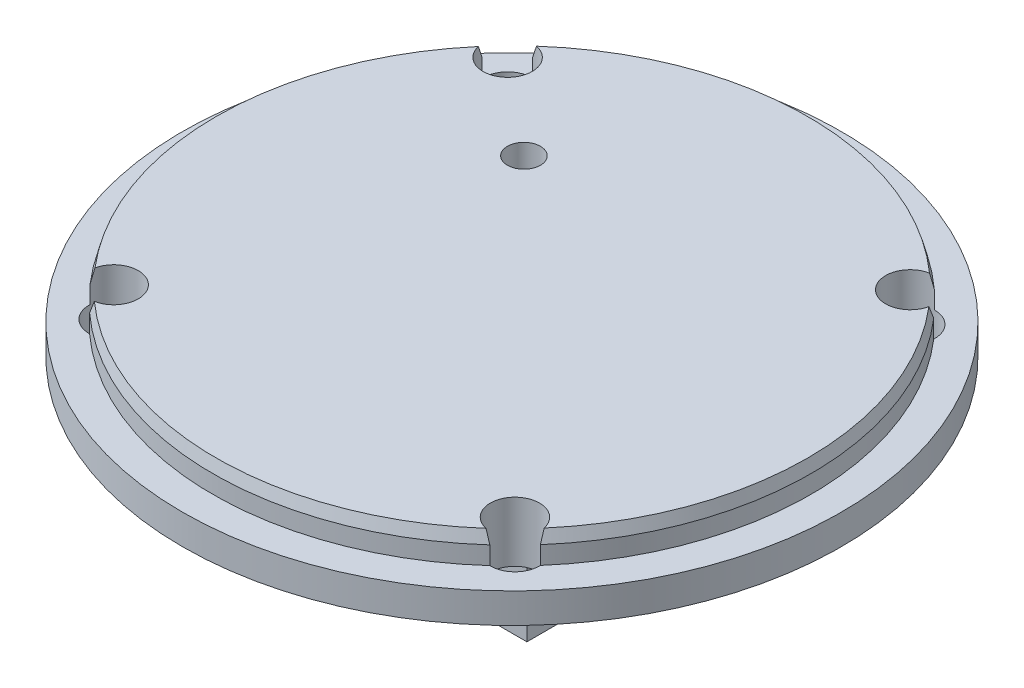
SolidWorks part; units mm, degrees
ref_plane "Спереди" through (0, 0, 0) normal (0, 0, 1) x (1, 0, 0)
ref_plane "Сверху" through (0, 0, 0) normal (0, 1, 0) x (1, 0, 0)
ref_plane "Справа" through (0, 0, 0) normal (1, 0, 0) x (0, 0, -1)
sketch "Эскиз1" plane through (0, 0, 0) normal (0, 1, 0) x (1, 0, 0)
  circle A0 centre (0, 0) radius 55
  dimension "D1" = 110
extrude "Бобышка-Вытянуть1" add sketch "Эскиз1" along normal blind 5
sketch "Эскиз2" plane through (0, 5, 0) normal (0, 1, 0) x (1, 0, 0)
  circle A0 centre (0, 0) radius 49.9
  dimension "D1" = 99.8
extrude "Бобышка-Вытянуть2" add sketch "Эскиз2" along normal blind 5
sketch "Эскиз3" plane through (0, 0, 0) normal (0, -1, 0) x (1, 0, 0)
  line L1 (17.5, -15) -> (-17.5, -15)
  line L2 (17.5, -15) -> (17.5, 15)
  line L3 (17.5, 15) -> (-17.5, 15)
  line L4 (-17.5, -15) -> (-17.5, 15)
  line L5 (17.5, -15) -> (-17.5, 15) construction
  line L6 (17.5, 15) -> (-17.5, -15) construction
  point P0 (0, 0)
  dimension "D1" = 35
  dimension "D2" = 30
extrude "Бобышка-Вытянуть3" add sketch "Эскиз3" along normal blind 25
sketch "Эскиз4" plane through (0, 0, 15) normal (0, 0, 1) x (1, 0, 0)
  line L0 (-17.5, 0) -> (17.5, -25) construction
  line L2 (10.1, -17.65) -> (-10.1, -17.65)
  line L3 (10.1, -17.65) -> (10.1, -7.35)
  line L4 (10.1, -7.35) -> (-10.1, -7.35)
  line L5 (-10.1, -17.65) -> (-10.1, -7.35)
  line L6 (10.1, -17.65) -> (-10.1, -7.35) construction
  line L7 (10.1, -7.35) -> (-10.1, -17.65) construction
  point P4 (0, -12.5)
  dimension "D1" = 20.2
  dimension "D2" = 10.3
extrude "Вырез-Вытянуть1" cut sketch "Эскиз4" against normal through all
sketch "Эскиз5" plane through (0, 0, 0) normal (0, -1, 0) x (1, 0, 0)
  line L0 (23.35, -22.85) -> (39.3102, -38.467) construction
  line L5 (-23.35, 22.85) -> (23.35, -22.85) construction
  line L6 (-23.35, -22.85) -> (23.35, 22.85) construction
  line L7 (-23.35, 22.85) -> (-39.3095, 38.4677) construction
  line L8 (23.35, 22.85) -> (39.1401, 38.6401) construction
  line L9 (-23.35, -22.85) -> (-39.3095, -38.4677) construction
  circle A0 centre (0, 0) radius 55 construction
  circle A1 centre (33.5922, -32.8719) radius 4.1
  circle A2 centre (-33.5917, -32.8724) radius 4.1
  circle A3 centre (-33.5917, 32.8724) radius 4.1
  circle A4 centre (33.4832, 32.9832) radius 4.1
  point P0 (0, 0)
  dimension "D3" = 8.2
  dimension "D1" = 46.7
  dimension "D2" = 45.7
  dimension "D4" = 8
  dimension "D5" = 8
  dimension "D6" = 8
  dimension "D7" = 8
extrude "Вырез-Вытянуть2" cut sketch "Эскиз5" against normal through all
sketch "Эскиз6" plane through (0, 10, 0) normal (0, 1, 0) x (1, 0, 0)
  line L0 (0, 0) -> (0.0004, 49.9) construction
  line L1 (0.0001, 20) -> (-17.9999, 20) construction
  arc A0 (33.5133, 36.9712) -> (-33.5128, 36.9717) centre (0, 0) ccw construction
  circle A1 centre (-17.9999, 20) radius 2.75
  dimension "D3" = 5.5
  dimension "D1" = 20
  dimension "D2" = 18
extrude "Вырез-Вытянуть3" cut sketch "Эскиз6" against normal through all
chamfer "Chamfer1" distance 2 angle 15 4 edges at (-0.0824, 10, 49.8999) (-49.9, 10, 0) (0.0004, 10, -49.9) (49.8999, 10, 0.0826)
